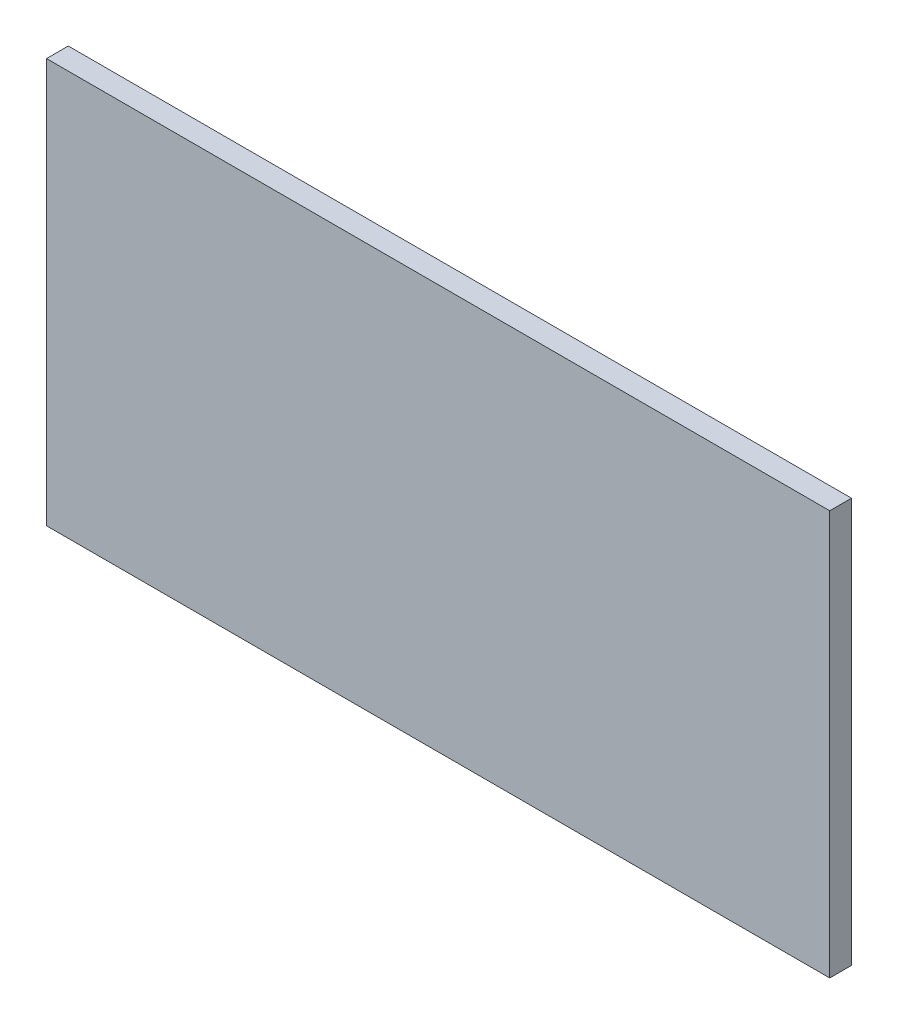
SolidWorks part; units mm, degrees
ref_plane "Plan de face" through (0, 0, 0) normal (0, 0, 1) x (1, 0, 0)
ref_plane "Plan de dessus" through (0, 0, 0) normal (0, 1, 0) x (1, 0, 0)
ref_plane "Plan de droite" through (0, 0, 0) normal (1, 0, 0) x (0, 0, -1)
sketch "Esquisse1" plane through (0, 0, 0) normal (0, 0, 1) x (1, 0, 0)
  line L1 (-90, 46.5) -> (90, 46.5)
  line L2 (-90, 46.5) -> (-90, -46.5)
  line L3 (-90, -46.5) -> (90, -46.5)
  line L4 (90, 46.5) -> (90, -46.5)
  point P4 (0, 46.5)
  point P5 (-90, 0)
  dimension "D1" = 180
  dimension "D2" = 93
extrude "Extrusion1" add sketch "Esquisse1" along normal blind 5
